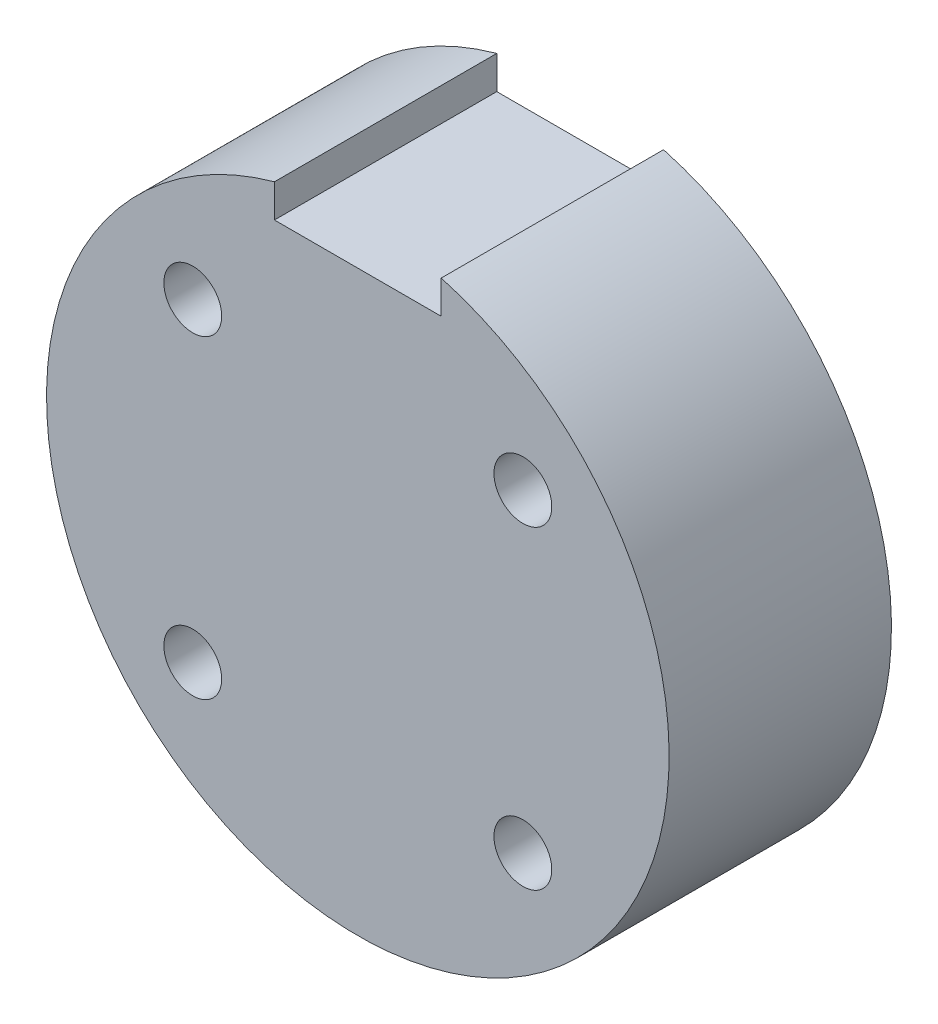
SolidWorks part; units mm, degrees
ref_plane "正面" through (0, 0, 0) normal (0, 0, 1) x (1, 0, 0)
ref_plane "平面" through (0, 0, 0) normal (0, 1, 0) x (1, 0, 0)
ref_plane "右側面" through (0, 0, 0) normal (1, 0, 0) x (0, 0, -1)
sketch "ｽｹｯﾁ1" plane through (0, 0, 0) normal (0, 0, 1) x (1, 0, 0)
  circle A0 centre (0, 0) radius 28
  dimension "D1" = 56
extrude "ﾎﾞｽ - 押し出し3" add sketch "ｽｹｯﾁ1" along normal blind 20
sketch "ｽｹｯﾁ15" plane through (0, 0, 0) normal (0, 0, -1) x (-1, 0, 0)
  circle A0 centre (-14.8459, 14.1368) radius 2.6
  circle A1 centre (14.8459, 14.1368) radius 2.6
  circle A2 centre (14.8459, -14.1368) radius 2.6
  circle A3 centre (-14.8459, -14.1368) radius 2.6
  dimension "D2" = 5.2
  dimension "D5" = 20.5
  dimension "D6" = 20.5
  dimension "D7" = 20.5
  dimension "D8" = 20.5
extrude "ｶｯﾄ - 押し出し1" cut sketch "ｽｹｯﾁ15" against normal through all
ref_plane "平面1" through (0, 50, 0) normal (0, 1, 0) x (1, 0, 0)
ref_plane "平面2" through (50, 0, 0) normal (1, 0, 0) x (0, 0, -1)
ref_plane "平面4" through (0, -50, 0) normal (0, 1, 0) x (1, 0, 0)
ref_plane "平面5" through (-50, 0, 0) normal (1, 0, 0) x (0, 0, -1)
sketch "ｽｹｯﾁ16" plane through (0, 50, 0) normal (0, 1, 0) x (1, 0, 0)
  line L0 (-50, -11) -> (-50, 11) construction
  line L1 (-7.5, 0) -> (7.5, 0)
  line L2 (-7.5, 0) -> (-7.5, -20)
  line L3 (-7.5, -20) -> (7.5, -20)
  line L4 (7.5, 0) -> (7.5, -20)
  line L5 (0, -20) -> (0, 0) construction
  line L6 (-7.5, -10) -> (7.5, -10) construction
  line L7 (-28, -20) -> (28, -20) construction
  point P0 (0, -10)
  dimension "D1" = 20
  dimension "D2" = 15
  dimension "D3" = 50
  dimension "D4" = 10
extrude "ｶｯﾄ - 押し出し4" cut sketch "ｽｹｯﾁ16" against normal blind 5 from offset 21
sketch "ｽｹｯﾁ17" plane through (0, 0, 0) normal (0, 0, -1) x (-1, 0, 0)
  circle A0 centre (0, 0) radius 7.5
extrude "ｶｯﾄ - 押し出し5" cut sketch "ｽｹｯﾁ17" against normal blind 8 contours A0
sketch "ｽｹｯﾁ18" plane through (0, -50, 0) normal (0, 1, 0) x (1, 0, 0)
  line L0 (-28, -20) -> (28, -20) construction
  circle A1 centre (0, -10) radius 2.5
  dimension "D2" = 5
  dimension "D1" = 10
extrude "ｶｯﾄ - 押し出し6" cut sketch "ｽｹｯﾁ18" along normal blind 15 from offset 21
